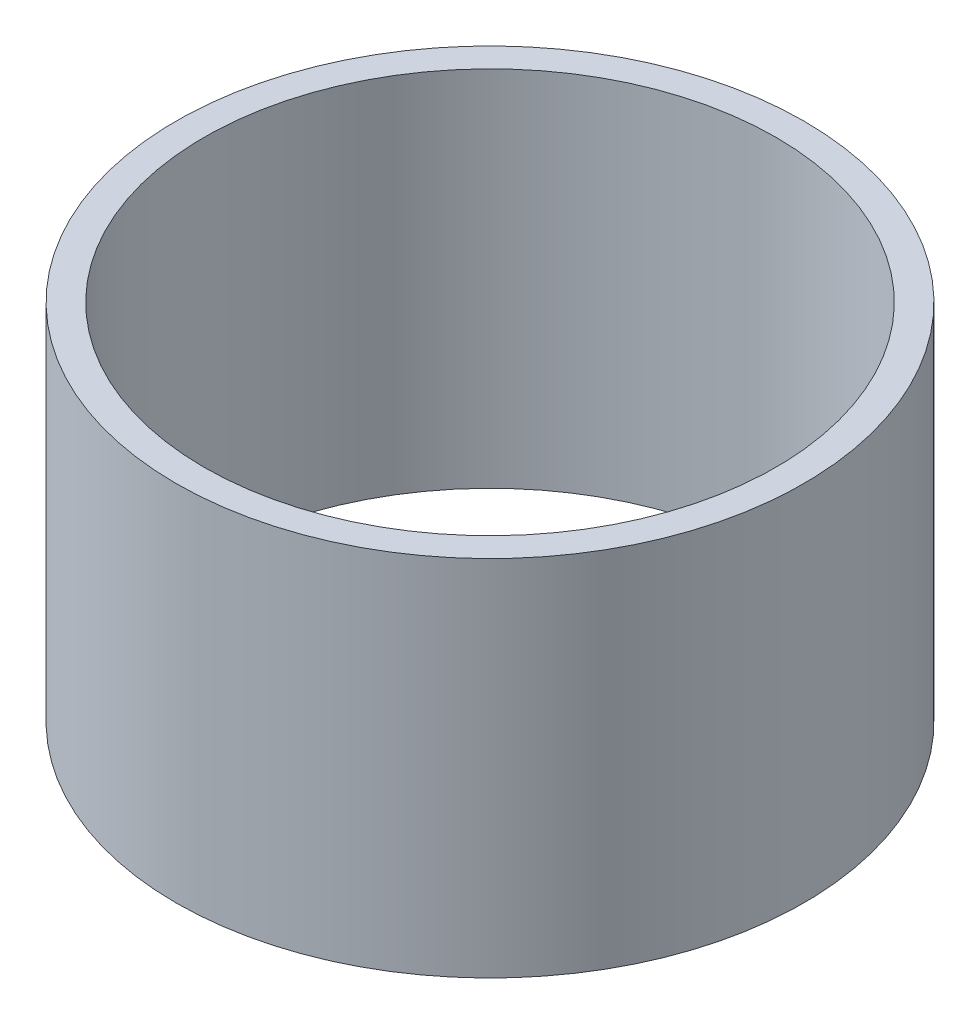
SolidWorks part; units mm, degrees
ref_plane "前视基准面" through (0, 0, 0) normal (0, 0, 1) x (1, 0, 0)
ref_plane "上视基准面" through (0, 0, 0) normal (0, 1, 0) x (1, 0, 0)
ref_plane "右视基准面" through (0, 0, 0) normal (1, 0, 0) x (0, 0, -1)
sketch "草图1" plane through (0, 0, 0) normal (0, 1, 0) x (1, 0, 0)
  circle A0 centre (0, 0) radius 14
  circle A1 centre (0, 0) radius 12.75
  dimension "D1" = 25.5
  dimension "D2" = 28
extrude "凸台-拉伸1" add sketch "草图1" along normal blind 16.2
